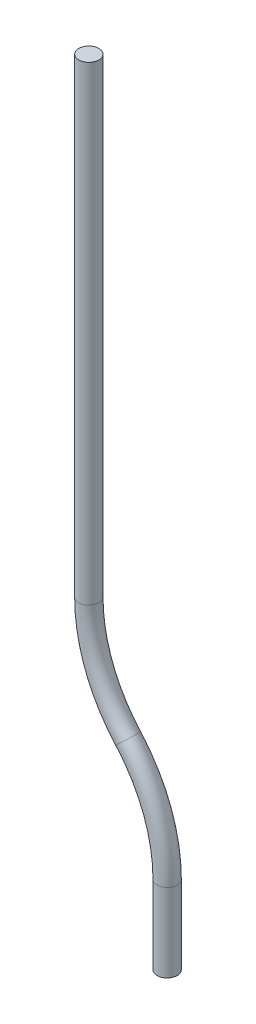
SolidWorks part; units mm, degrees
ref_plane "Front Plane" through (0, 0, 0) normal (0, 0, 1) x (1, 0, 0)
ref_plane "Top Plane" through (0, 0, 0) normal (0, 1, 0) x (1, 0, 0)
ref_plane "Right Plane" through (0, 0, 0) normal (1, 0, 0) x (0, 0, -1)
sketch "Sketch1" plane through (0, 0, 0) normal (0, 0, 1) x (1, 0, 0)
  line L0 (0, 0) -> (0, 25.4)
  line L1 (-25.4, 91.9946) -> (-25.4, 244.3946)
  arc A0 (0, 25.4) -> (-12.7, 58.6973) centre (-50, 25.4) ccw
  arc A1 (-25.4, 91.9946) -> (-12.7, 58.6973) centre (24.6, 91.9946) ccw
  dimension "D1" = 50
  dimension "D2" = 25.4
  dimension "D3" = 152.4
  dimension "D4" = 25.4
sketch "Sketch2" plane through (0, 0, 0) normal (0, 1, 0) x (1, 0, 0)
  circle A0 centre (0, 0) radius 3.25
  dimension "D1" = 6.5
sweep "Sweep1" add profiles "Sketch2" path "Sketch1"
